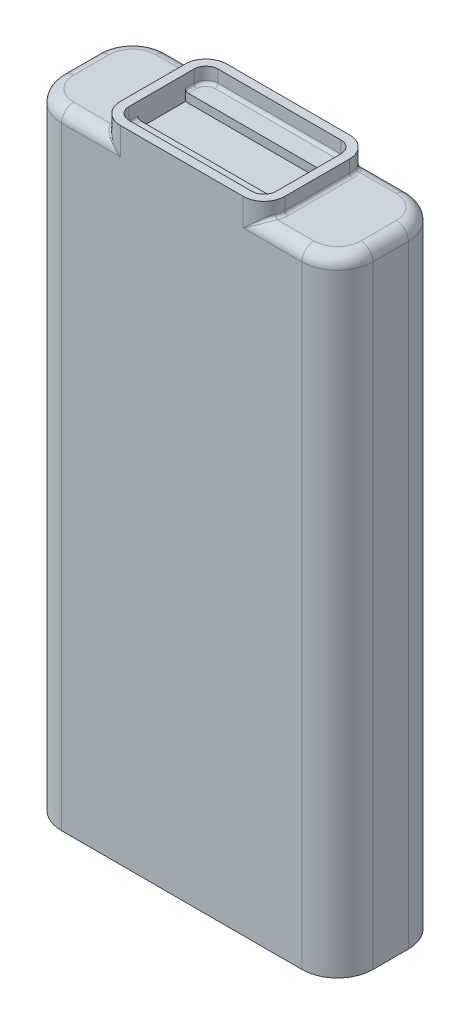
SolidWorks part; units mm, degrees
ref_plane "Front Plane" through (0, 0, 0) normal (0, 0, 1) x (1, 0, 0)
ref_plane "Top Plane" through (0, 0, 0) normal (0, 1, 0) x (1, 0, 0)
ref_plane "Right Plane" through (0, 0, 0) normal (1, 0, 0) x (0, 0, -1)
sketch "Sketch1" plane through (0, 0, 0) normal (0, 1, 0) x (1, 0, 0)
  line L6 (-31.5722, -13.97) -> (31.5722, -13.97)
  line L7 (-40.894, -4.6482) -> (-40.894, 4.6482)
  line L8 (-31.5722, 13.97) -> (31.5722, 13.97)
  line L9 (40.894, -4.6482) -> (40.894, 4.6482)
  line L10 (-40.894, -13.97) -> (40.894, 13.97) construction
  line L11 (-40.894, 13.97) -> (40.894, -13.97) construction
  arc A4 (31.5722, 13.97) -> (40.894, 4.6482) centre (31.5722, 4.6482) cw
  arc A5 (31.5722, -13.97) -> (40.894, -4.6482) centre (31.5722, -4.6482) ccw
  arc A6 (-31.5722, -13.97) -> (-40.894, -4.6482) centre (-31.5722, -4.6482) cw
  arc A7 (-40.894, 4.6482) -> (-31.5722, 13.97) centre (-31.5722, 4.6482) cw
  point P2 (0, 0)
  dimension "D1" = 9.3218
  dimension "D3" = 81.788
  dimension "D4" = 27.94
extrude "Boss-Extrude1" add sketch "Sketch1" along normal blind 168.148
sketch "Sketch2" plane through (0, 168.148, 0) normal (0, 1, 0) x (1, 0, 0)
  line L0 (-16.129, 13.97) -> (-31.5722, 13.97)
  line L1 (16.129, 13.97) -> (31.5722, 13.97)
  line L2 (16.129, -13.97) -> (31.5722, -13.97)
  line L3 (-31.5722, -13.97) -> (-16.129, -13.97)
  line L17 (-16.129, -11.684) -> (16.129, -11.684)
  line L18 (-19.304, -8.509) -> (-19.304, 8.509)
  line L19 (-16.129, 11.684) -> (16.129, 11.684)
  line L20 (-40.894, 4.6482) -> (-40.894, -4.6482)
  line L21 (-31.5722, -13.97) -> (31.5722, -13.97)
  line L22 (40.894, -4.6482) -> (40.894, 4.6482)
  line L23 (31.5722, 13.97) -> (-31.5722, 13.97)
  line L24 (-40.894, 4.6482) -> (-40.894, -4.6482)
  line L26 (40.894, -4.6482) -> (40.894, 4.6482)
  line L28 (19.304, -8.509) -> (19.304, 8.509)
  line L29 (-19.304, -11.684) -> (19.304, 11.684) construction
  line L30 (-19.304, 11.684) -> (19.304, -11.684) construction
  line L32 (-21.59, -8.509) -> (-21.59, 8.509)
  line L34 (21.59, -8.509) -> (21.59, 8.509)
  line L35 (-21.59, -13.97) -> (21.59, 13.97) construction
  line L36 (-21.59, 13.97) -> (21.59, -13.97) construction
  arc A20 (16.129, -11.684) -> (19.304, -8.509) centre (16.129, -8.509) ccw
  arc A21 (16.129, 11.684) -> (19.304, 8.509) centre (16.129, 8.509) cw
  arc A22 (-16.129, -11.684) -> (-19.304, -8.509) centre (-16.129, -8.509) cw
  arc A23 (-19.304, 8.509) -> (-16.129, 11.684) centre (-16.129, 8.509) cw
  arc A24 (-40.894, -4.6482) -> (-31.5722, -13.97) centre (-31.5722, -4.6482) ccw
  arc A25 (31.5722, -13.97) -> (40.894, -4.6482) centre (31.5722, -4.6482) ccw
  arc A26 (40.894, 4.6482) -> (31.5722, 13.97) centre (31.5722, 4.6482) ccw
  arc A27 (-31.5722, 13.97) -> (-40.894, 4.6482) centre (-31.5722, 4.6482) ccw
  arc A28 (-40.894, -4.6482) -> (-31.5722, -13.97) centre (-31.5722, -4.6482) ccw
  arc A29 (31.5722, -13.97) -> (40.894, -4.6482) centre (31.5722, -4.6482) ccw
  arc A30 (40.894, 4.6482) -> (31.5722, 13.97) centre (31.5722, 4.6482) ccw
  arc A31 (-31.5722, 13.97) -> (-40.894, 4.6482) centre (-31.5722, 4.6482) ccw
  arc A32 (-16.129, -13.97) -> (-21.59, -8.509) centre (-16.129, -8.509) cw
  arc A33 (16.129, -13.97) -> (21.59, -8.509) centre (16.129, -8.509) ccw
  arc A34 (16.129, 13.97) -> (21.59, 8.509) centre (16.129, 8.509) cw
  arc A35 (-21.59, 8.509) -> (-16.129, 13.97) centre (-16.129, 8.509) cw
  point P0 (0, 0)
  point P18 (0, 0)
  dimension "D5" = 3.175
  dimension "D6" = 5.461
  dimension "D2" = 2.286
  dimension "D3" = 2.286
  dimension "D4" = 43.18
  dimension "D7" = 2.286
  dimension "D1" = 0
extrude "Cut-Extrude1" cut sketch "Sketch2" against normal blind 4.0132
fillet "Fillet1" radius 3.175 10 edges at (-23.8506, 164.1348, -13.97) (-38.1637, 164.1348, -11.2397) (-23.8506, 164.1348, 13.97) (-38.1637, 164.1348, 11.2397) (23.8506, 164.1348, 13.97) (38.1637, 164.1348, 11.2397) (23.8506, 164.1348, -13.97) (38.1637, 164.1348, -11.2397) (-40.894, 164.1348, 0) (40.894, 164.1348, 0)
sketch "Sketch3" plane through (0, 164.1348, 0) normal (0, 1, 0) x (1, 0, 0)
  line L1 (-19.304, 6.27) -> (19.304, 6.27)
  line L2 (-19.304, 6.27) -> (-19.304, -6.27)
  line L3 (-19.304, -6.27) -> (19.304, -6.27)
  line L4 (19.304, 6.27) -> (19.304, -6.27)
  line L5 (-18.57, 6.27) -> (18.57, 6.27) construction
  line L7 (18.57, -6.27) -> (-18.57, -6.27) construction
  line L8 (-19.304, 8.509) -> (-19.304, -8.509) construction
  line L9 (19.304, -8.509) -> (19.304, 8.509) construction
extrude "Cut-Extrude2" cut sketch "Sketch3" against normal offset from surface (2.2538 mm away) 0.127
fillet "Fillet3" radius 0.7937 20 edges at (-19.304, 164.1348, 7.3895) (-18.3741, 164.1348, 10.7541) (19.304, 164.1348, 7.3895) (18.3741, 164.1348, 10.7541) (19.304, 164.1348, -7.3895) (18.3741, 164.1348, -10.7541) (-19.304, 164.1348, -7.3895) (-18.3741, 164.1348, -10.7541) (19.4063, 163.3566, -12.8773) (21.4632, 164.1348, -9.6792) (19.4063, 163.3566, 12.8773) (21.4632, 164.1348, 9.6792) (-19.4063, 163.3566, 12.8773) (-21.4632, 164.1348, 9.6792) (-19.4063, 163.3566, -12.8773) (-21.4632, 164.1348, -9.6792) (0, 164.1348, 11.684) (0, 164.1348, -11.684) (21.59, 164.1348, 0) (-21.59, 164.1348, 0)
sketch "Sketch4" plane through (0, 0, -13.97) normal (0, 0, -1) x (-1, 0, 0)
  line L0 (0, 0) -> (0, 6.9088) construction
  line L1 (-26.67, 154.2288) -> (26.67, 154.2288) construction
  line L2 (-26.67, 154.2288) -> (-26.67, 6.9088) construction
  line L3 (-26.67, 6.9088) -> (26.67, 6.9088) construction
  line L4 (26.67, 154.2288) -> (26.67, 6.9088) construction
  line L5 (-31.5722, 0) -> (31.5722, 0) construction
  line L6 (-16.129, 168.148) -> (16.129, 168.148) construction
  dimension "D1" = 13.9192
  dimension "D2" = 147.32
  dimension "D3" = 53.34
